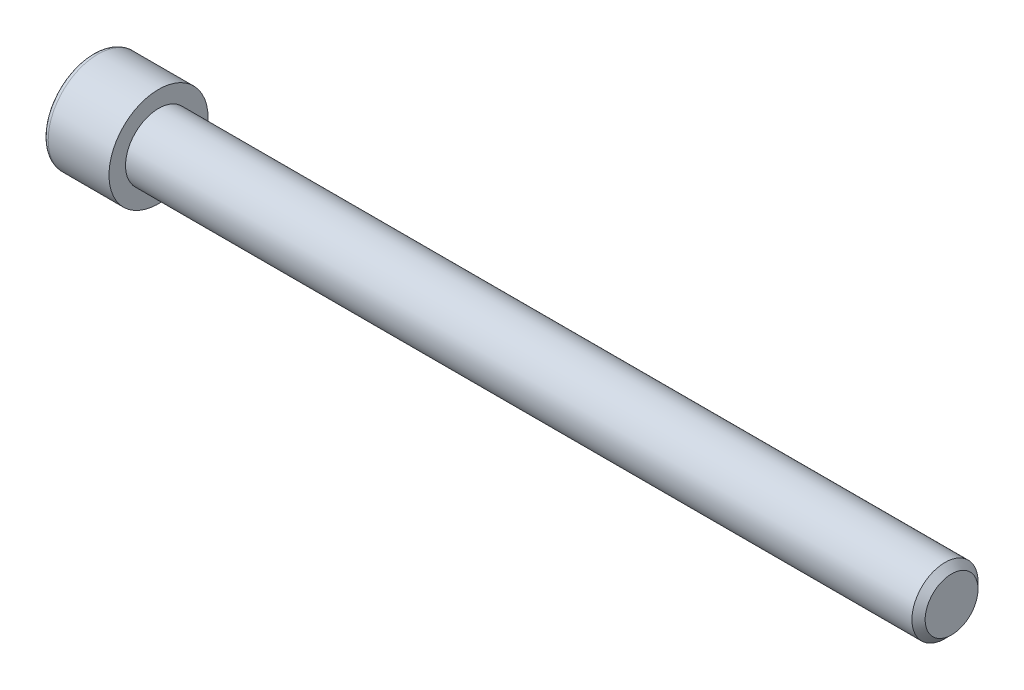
SolidWorks part; units mm, degrees
ref_plane "Front Plane" through (0, 0, 0) normal (0, 0, 1) x (1, 0, 0)
ref_plane "Top Plane" through (0, 0, 0) normal (0, 1, 0) x (1, 0, 0)
ref_plane "Right Plane" through (0, 0, 0) normal (1, 0, 0) x (0, 0, -1)
sketch "Sketch1" plane through (0, 0, 0) normal (0, 0, 1) x (1, 0, 0)
  line L0 (0, 0) -> (82.55, 0)
  line L1 (82.55, 0) -> (82.55, 3.175)
  line L2 (82.55, 3.175) -> (6.35, 3.175)
  line L3 (6.35, 3.175) -> (6.35, 4.7625)
  line L4 (6.35, 4.7625) -> (0, 4.7625)
  line L5 (0, 4.7625) -> (0, 0)
  line L6 (0, 0) -> (-23.3079, 0) construction
  dimension "D1" = 6.35
  dimension "D2" = 9.525
  dimension "D3" = 6.35
  dimension "D4" = 76.2
revolve "Revolve1" add sketch "Sketch1" angle 360 about L6
sketch "Sketch2" plane through (0, 0, 0) normal (-1, 0, 0) x (0, 0, 1)
  line L1 (-1.3785, -2.3876) -> (1.3785, -2.3876)
  line L2 (1.3785, -2.3876) -> (2.757, 0)
  line L3 (2.757, 0) -> (1.3785, 2.3876)
  line L4 (1.3785, 2.3876) -> (-1.3785, 2.3876)
  line L5 (-1.3785, 2.3876) -> (-2.757, 0)
  line L6 (-2.757, 0) -> (-1.3785, -2.3876)
  circle A0 centre (0, 0) radius 2.3876 construction
  dimension "D1" = 4.7752
extrude "Cut-Extrude1" cut sketch "Sketch2" against normal blind 3.9624
fillet "Fillet1" radius 0.508 1 edges at (0, 0, -4.7625)
chamfer "Chamfer1" distance 0.635 angle 45 1 edges at (82.55, 0, -3.175)
